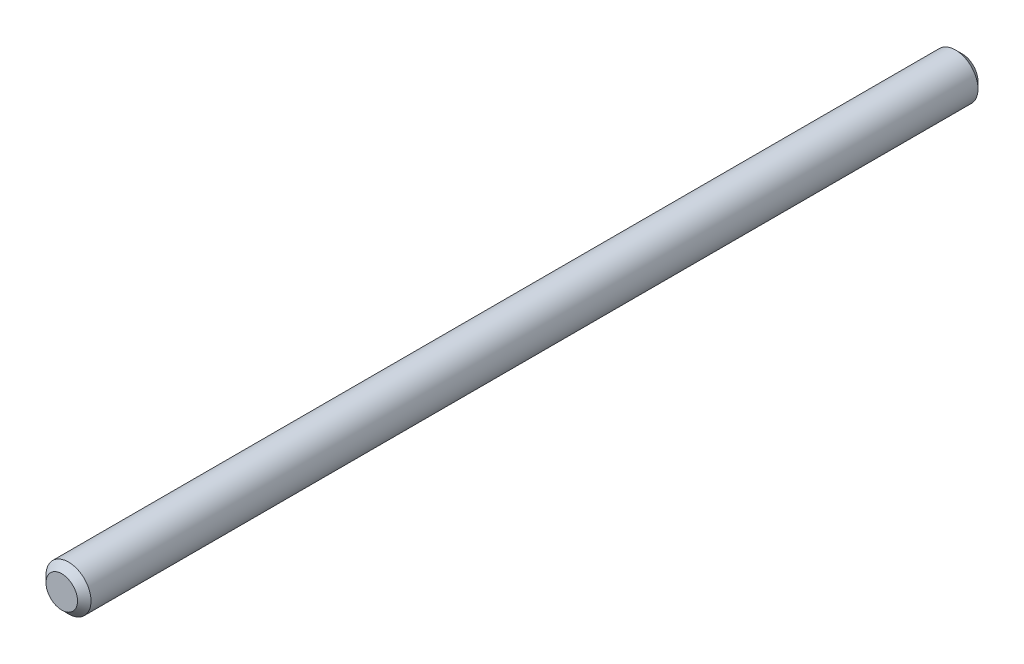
SolidWorks part; units mm, degrees
ref_plane "Plan1" through (0, 0, 0) normal (0, 0, 1) x (1, 0, 0)
ref_plane "Plan2" through (0, 0, 0) normal (0, 1, 0) x (1, 0, 0)
ref_plane "Plan3" through (0, 0, 0) normal (1, 0, 0) x (0, 0, -1)
sketch "Esquisse1" plane through (0, 0, 0) normal (0, 0, 1) x (1, 0, 0)
  circle A0 centre (0, 0) radius 1
  dimension "D1" = 2
extrude "Base-Extrusion" add sketch "Esquisse1" along normal blind 40
chamfer "Chanfrein1" distance 0.3 angle 45 2 edges at (1, 0, 0) (1, 0, 40)
